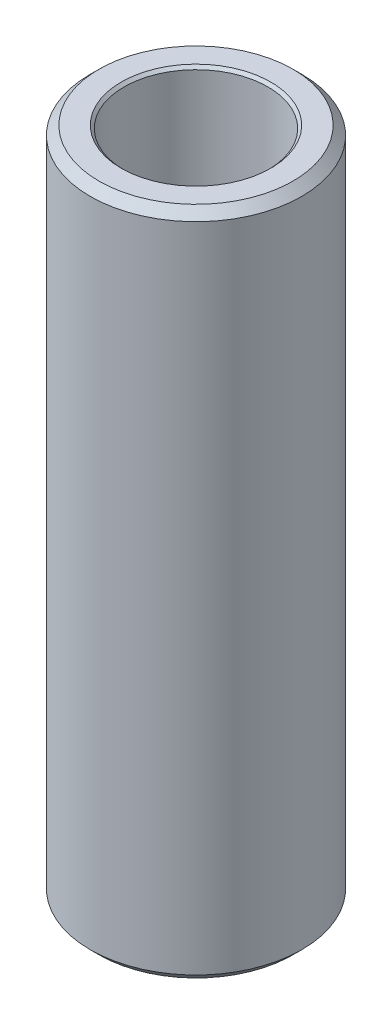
SolidWorks part; units mm, degrees
ref_plane "Plane1" through (0, 0, 0) normal (0, 0, 1) x (1, 0, 0)
ref_plane "Plane2" through (0, 0, 0) normal (0, 1, 0) x (1, 0, 0)
ref_plane "Plane3" through (0, 0, 0) normal (1, 0, 0) x (0, 0, -1)
sketch "Sketch1" plane through (0, 0, 0) normal (0, 0, 1) x (1, 0, 0)
  line L0 (0, 64.77) -> (0, -67.31) construction
  line L1 (6.477, 60.325) -> (9.525, 60.325)
  line L2 (6.477, 60.325) -> (6.477, 0)
  line L3 (9.525, 0) -> (6.477, 0)
  line L4 (9.525, 0) -> (9.525, 60.325)
  dimension "OR" = 9.525
  dimension "IR" = 6.477
  dimension "L" = 60.325
revolve "Base-Revolve" add sketch "Sketch1" angle 360 about L0
chamfer "Chamfer1" distance 0.7937 angle 45 2 edges at (0, 60.325, 9.525) (0, 0, 9.525)
chamfer "Chamfer2" distance 0.254 angle 45 2 edges at (0, 60.325, 6.477) (0, 0, 6.477)
